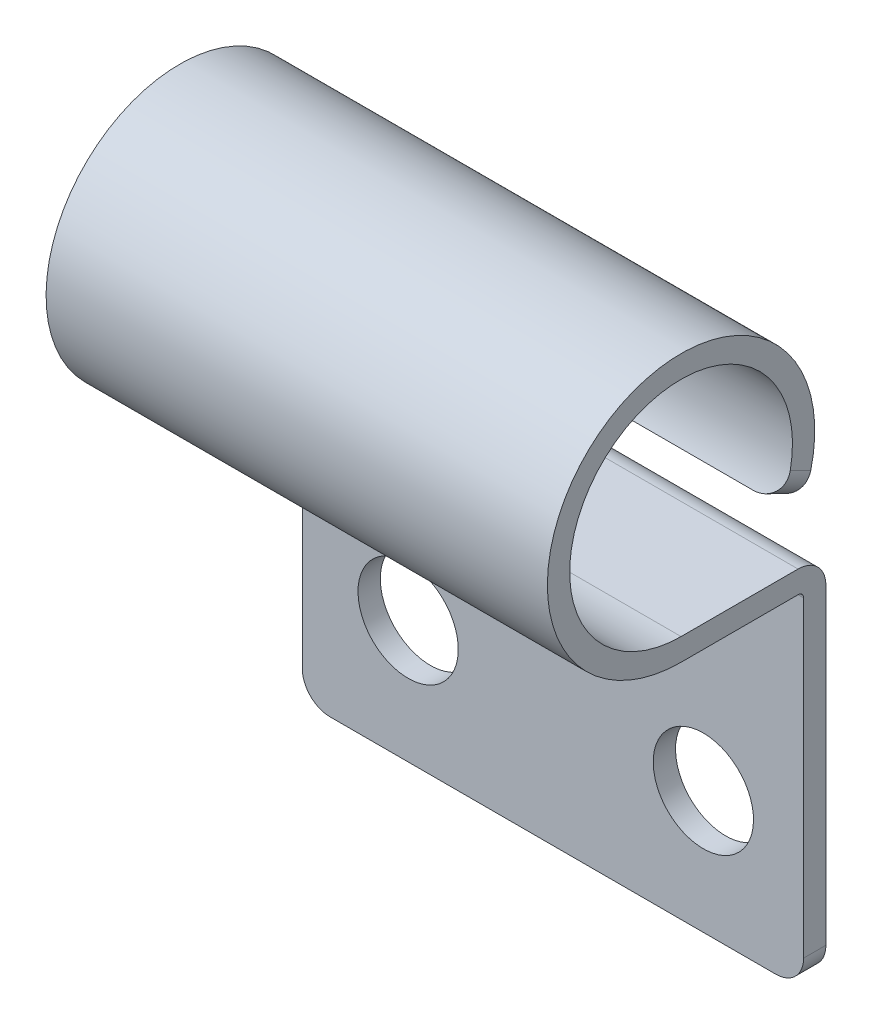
SolidWorks part; units mm, degrees
ref_plane "Front Plane" through (0, 0, 0) normal (0, 0, 1) x (1, 0, 0)
ref_plane "Top Plane" through (0, 0, 0) normal (0, 1, 0) x (1, 0, 0)
ref_plane "Right Plane" through (0, 0, 0) normal (1, 0, 0) x (0, 0, -1)
sketch "Sketch1" plane through (0, 0, 0) normal (1, 0, 0) x (0, 0, -1)
  line L0 (0, -2) -> (2.1, -2)
  line L1 (2.6, -2.5) -> (2.6, -8.6)
  arc A0 (1.7976, -0.8767) -> (0, -2) centre (0, 0) ccw
  arc A1 (2.1, -2) -> (2.6, -2.5) centre (2.1, -2.5) cw
  point P5 (1.7976, -0.8767)
  dimension "D1" = 4
  dimension "D4" = 0.5
  dimension "D2" = 2.6
  dimension "D3" = 8.6
extrude "Extrude-Thin1" add sketch "Sketch1" along normal blind 9 thin
sketch "Sketch2" plane through (0, 0, -2.6) normal (0, 0, -1) x (-1, 0, 0)
  line L0 (0, -2.5) -> (0, -8.6) construction
  circle A0 centre (-1.9, -6.4) radius 0.9
  circle A1 centre (-7.2, -6.4) radius 0.9
  point P2 (0, -5.55)
  dimension "D1" = 1.8
  dimension "D3" = 1.8
  dimension "D6" = 7.2
  dimension "D5" = 1.9
  dimension "D2" = 6.4
  dimension "D4" = 6.4
extrude "Cut-Extrude1" cut sketch "Sketch2" against normal through all
sketch "Sketch3" plane through (0, 0, -2.6) normal (0, 0, -1) x (-1, 0, 0)
  line L0 (-9, -2.5) -> (-9, -8.6) construction
  circle A0 centre (-4.45, -3.7) radius 0.7
  dimension "D1" = 1.4
  dimension "D2" = 4.55
  dimension "D3" = 3.7
extrude "Cut-Extrude2" cut sketch "Sketch3" against normal through all
fillet "Fillet1" radius 0.5 4 edges at (0, -8.6, -2.4) (9, -8.6, -2.4) (0, -0.9643, -1.9774) (9, -0.9643, -1.9774)
